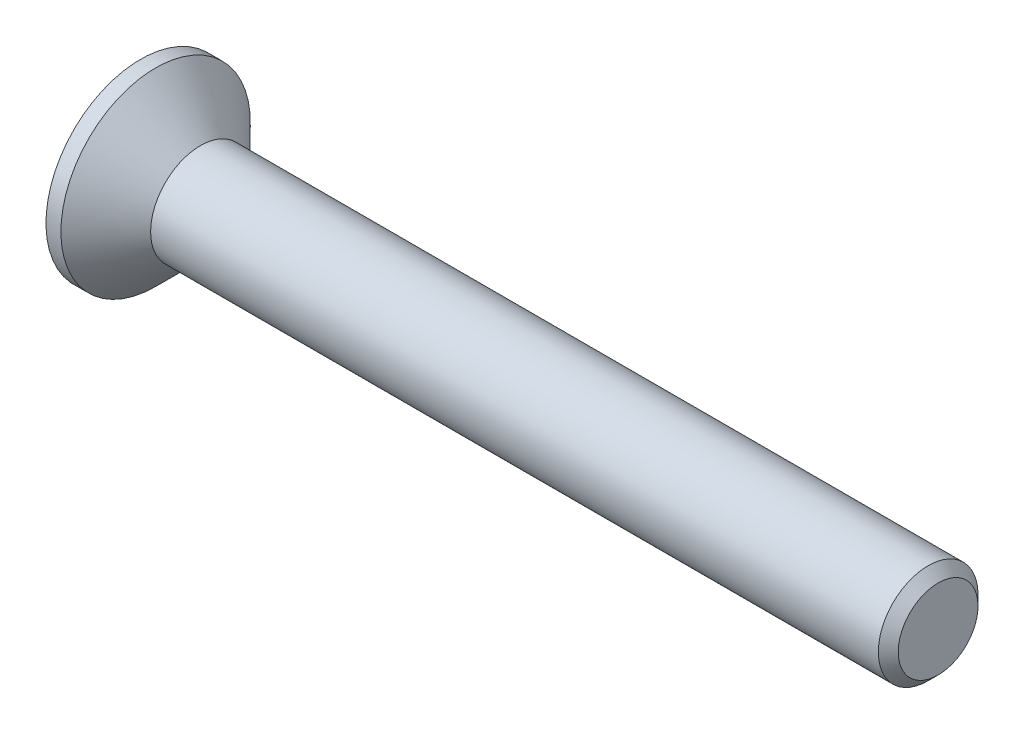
SolidWorks part; units mm, degrees
ref_plane "Front Plane" through (0, 0, 0) normal (0, 0, 1) x (1, 0, 0)
ref_plane "Top Plane" through (0, 0, 0) normal (0, 1, 0) x (1, 0, 0)
ref_plane "Right Plane" through (0, 0, 0) normal (1, 0, 0) x (0, 0, -1)
sketch "Sketch1" plane through (0, 0, 0) normal (0, 0, 1) x (1, 0, 0)
  line L1 (-1.2, 1.9) -> (-1.2, 0)
  line L2 (-1.2, 0) -> (14.8, 0)
  line L3 (14.8, 0) -> (14.8, 1)
  line L4 (14.8, 1) -> (0, 1)
  line L5 (-1.2, 1.9) -> (-0.9, 1.9)
  line L6 (-0.9, 1.9) -> (0, 1)
  dimension "D1" = 1
  dimension "D2" = 45
  dimension "D3" = 1.2
  dimension "D4" = 16
  dimension "D5" = 1.9
revolve "Revolve1" add sketch "Sketch1" angle 360 about L2
chamfer "Chamfer1" distance 0.2 angle 45 1 edges at (14.8, -1, 0)
sketch "Sketch2" plane through (-1.2, 0, 0) normal (-1, 0, 0) x (0, 0, 1)
  line L0 (-0.3, 1.175) -> (0.3, 1.175)
  line L1 (0.3, 1.175) -> (0.3, 0.3)
  line L2 (0.3, 0.3) -> (1.175, 0.3)
  line L3 (1.175, 0.3) -> (1.175, -0.3)
  line L4 (1.175, -0.3) -> (0.3, -0.3)
  line L5 (0.3, -0.3) -> (0.3, -1.175)
  line L6 (0.3, -1.175) -> (-0.3, -1.175)
  line L7 (-0.3, -1.175) -> (-0.3, -0.3)
  line L8 (-0.3, -0.3) -> (-1.175, -0.3)
  line L9 (-1.175, -0.3) -> (-1.175, 0.3)
  line L10 (-1.175, 0.3) -> (-0.3, 0.3)
  line L11 (-0.3, 0.3) -> (-0.3, 1.175)
  point P5 (0, 1.175)
  point P13 (1.175, 0)
  point P15 (-1.175, 0)
  point P16 (0, -1.175)
  point P17 (0.3, 1.085)
  dimension "D1" = 0.6
  dimension "D2" = 2.35
extrude "Cut-Extrude1" cut sketch "Sketch2" against normal blind 0.95
